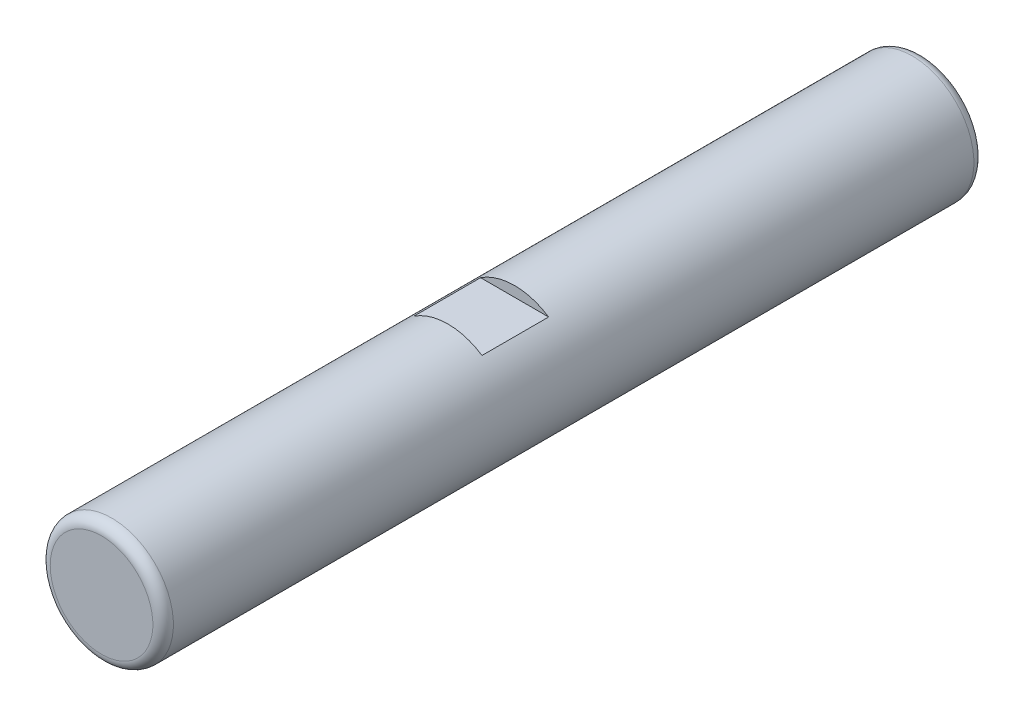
SolidWorks part; units mm, degrees
ref_plane "Front" through (0, 0, 0) normal (0, 0, 1) x (1, 0, 0)
ref_plane "Top" through (0, 0, 0) normal (0, 1, 0) x (1, 0, 0)
ref_plane "Right" through (0, 0, 0) normal (1, 0, 0) x (0, 0, -1)
sketch "Logo3_Revol_Axis" plane through (0, 0, 0) normal (0, 1, 0) x (1, 0, 0)
  line L0 (0, -30.1653) -> (0, 30.1653) construction
sketch "Logo3_bib1" plane through (0, 0, 0) normal (0, -1, 0) x (-1, 0, 0)
  line L0 (0, 38.1) -> (0, -88.9)
  line L1 (9.525, 36.5125) -> (9.525, -9.525)
  line L2 (0, -88.9) -> (7.9375, -88.9)
  line L3 (3.2639, -88.9) -> (3.2639, 0) construction
  line L4 (0, 38.1) -> (7.9375, 38.1)
  line L5 (3.2639, 0) -> (0, 1.8844) construction
  line L6 (9.525, 33.9827) -> (9.0319, 35.8228) construction
  line L10 (0, 41.5372) -> (0, -40.1764) construction
  line L11 (9.525, -9.525) -> (9.525, -87.3125)
  arc A0 (9.0319, 35.8228) -> (0, 38.1) centre (0, 19.05) ccw construction
  arc A1 (9.525, -87.3125) -> (7.9375, -88.9) centre (7.9375, -87.3125) cw
  arc A2 (9.525, 36.5125) -> (7.9375, 38.1) centre (7.9375, 36.5125) ccw
  point P0 (9.525, -88.9)
revolve "Revolve1" add sketch "Logo3_bib1" angle 360 about L10
sketch "Sketch4" plane through (0, 0, 0) normal (0, 1, 0) x (1, 0, 0)
  line L0 (15.875, -30.1625) -> (-9.5377, -30.1625) construction
  line L1 (15.875, -35.3187) -> (-15.875, -35.3187)
  line L2 (15.875, -35.3187) -> (15.875, -25.0063)
  line L3 (15.875, -25.0063) -> (-15.875, -25.0063)
  line L4 (-15.875, -35.3187) -> (-15.875, -25.0063)
  line L6 (0, -35.3187) -> (0, -25.0063) construction
  line L7 (0, 41.5372) -> (0, -40.1764) construction
  line L8 (-7.9375, -88.9) -> (7.9375, -88.9) construction
  dimension "D1" = 10.3124
  dimension "D2" = 31.75
  dimension "D3" = 58.7375
extrude "Cut-Extrude1" cut sketch "Sketch4" along normal through all from offset 7.9375
equation "\"Ray1@Logo3_bib1\" = \"logo3_d1@Logo3_bib1\""
equation "\"Dia1@Logo3_bib1\" = \"logo3_d1@Logo3_bib1\""
